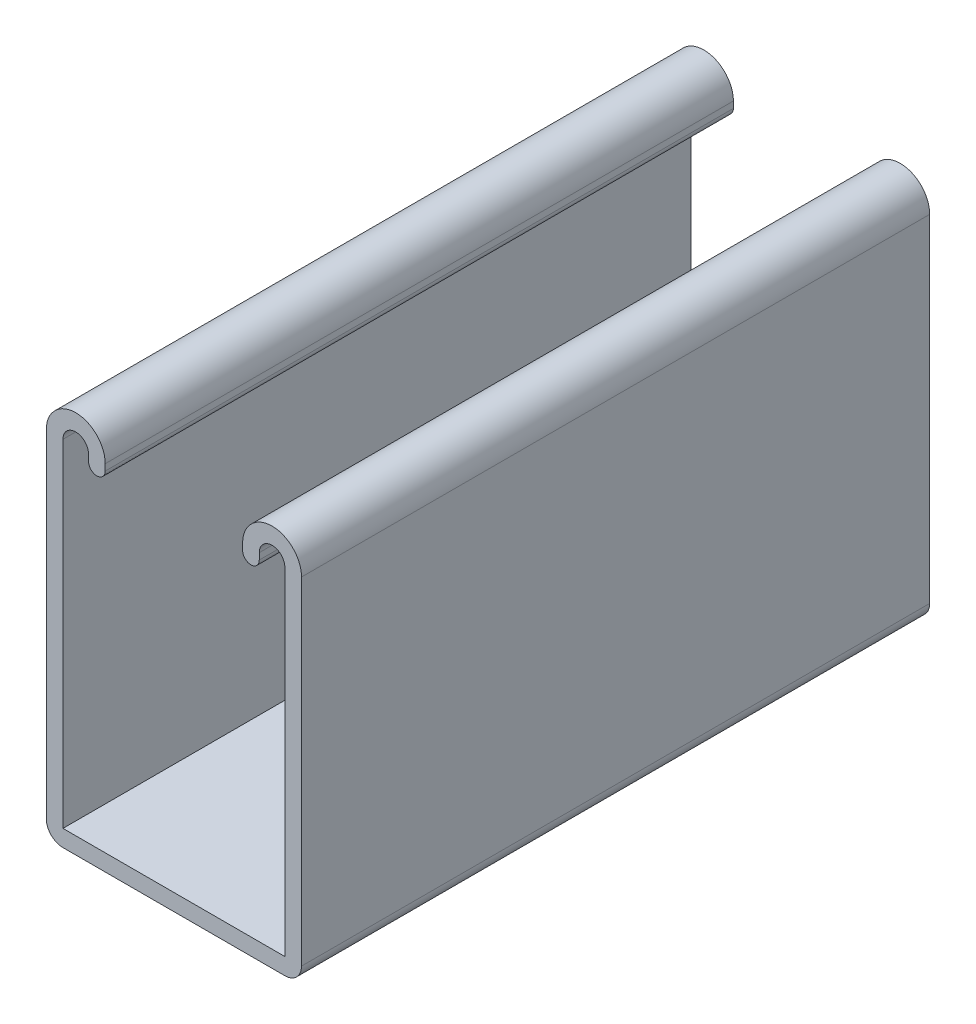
SolidWorks part; units mm, degrees
ref_plane "Plane1" through (0, 0, 0) normal (0, 0, 1) x (1, 0, 0)
ref_plane "Plane2" through (0, 0, 0) normal (0, 1, 0) x (1, 0, 0)
ref_plane "Plane3" through (0, 0, 0) normal (1, 0, 0) x (0, 0, -1)
sketch "Sketch1" plane through (0, 0, 0) normal (0, 0, 1) x (1, 0, 0)
  line L0 (-20.6375, 29.1719) -> (-20.6375, -25.3238)
  line L1 (-17.9451, -28.0162) -> (17.9451, -28.0162)
  line L2 (20.6375, -25.3238) -> (20.6375, 29.1719)
  line L3 (11.1125, 29.1719) -> (11.1125, 28.1369)
  line L4 (-11.1125, 29.1719) -> (-11.1125, 28.1369)
  line L5 (-13.8049, 29.1719) -> (-13.8049, 28.1369)
  line L6 (-17.9451, 29.1719) -> (-17.9451, -25.3238)
  line L7 (-17.9451, -25.3238) -> (17.9451, -25.3238)
  line L8 (17.9451, -25.3238) -> (17.9451, 29.1719)
  line L9 (13.8049, 29.1719) -> (13.8049, 28.1369)
  line L10 (-25.4, 33.9344) -> (25.4, 33.9344) construction
  line L11 (-12.8524, 26.7907) -> (12.8524, 26.7907) construction
  arc A0 (20.6375, 29.1719) -> (11.1125, 29.1719) centre (15.875, 29.1719) ccw
  arc A1 (-20.6375, 29.1719) -> (-11.1125, 29.1719) centre (-15.875, 29.1719) cw
  arc A2 (-17.9451, -28.0162) -> (-20.6375, -25.3238) centre (-17.9451, -25.3238) cw
  arc A3 (17.9451, -28.0162) -> (20.6375, -25.3238) centre (17.9451, -25.3238) ccw
  arc A4 (-17.9451, 29.1719) -> (-13.8049, 29.1719) centre (-15.875, 29.1719) cw
  arc A5 (17.9451, 29.1719) -> (13.8049, 29.1719) centre (15.875, 29.1719) ccw
  arc A6 (11.1125, 28.1369) -> (13.8049, 28.1369) centre (12.4587, 28.1369) ccw
  arc A7 (-11.1125, 28.1369) -> (-13.8049, 28.1369) centre (-12.4587, 28.1369) cw
  dimension "D1" = 2.6924
  dimension "D3" = 20.6375
  dimension "Width" = 41.275
  dimension "D5" = 28.0162
  dimension "D6" = 9.525
  dimension "D7" = 22.225
  dimension "D8" = 33.9344
  dimension "D9" = 7.1437
  dimension "gauge" = 2.6924
extrude "Base-Extrude" add sketch "Sketch1" along normal blind 101.6
other "Hole1"
sketch "Sketch3" plane through (0, -28.0162, 0) normal (0, -1, 0) x (1, 0, 0)
  circle A0 centre (0, 23.8125) radius 7.1438
  dimension "D1" = 14.2875
  dimension "D2" = 23.8125
pattern_linear "LPattern2" count 2 spacing 47.625 along (0, 0, 1) of "Hole1"
equation "\"D3@Sketch1\" = \"Width@Sketch1\" / 2"
equation "\"D7@Sketch1\" = \"Width@Sketch1\" - 2 * \"D6@Sketch1\""
equation "\"D1@Sketch1\" = \"gauge@Sketch1\""
equation "\"D1@LPattern2\" = \"D1@Base-Extrude\" / \"D3@LPattern2\""
